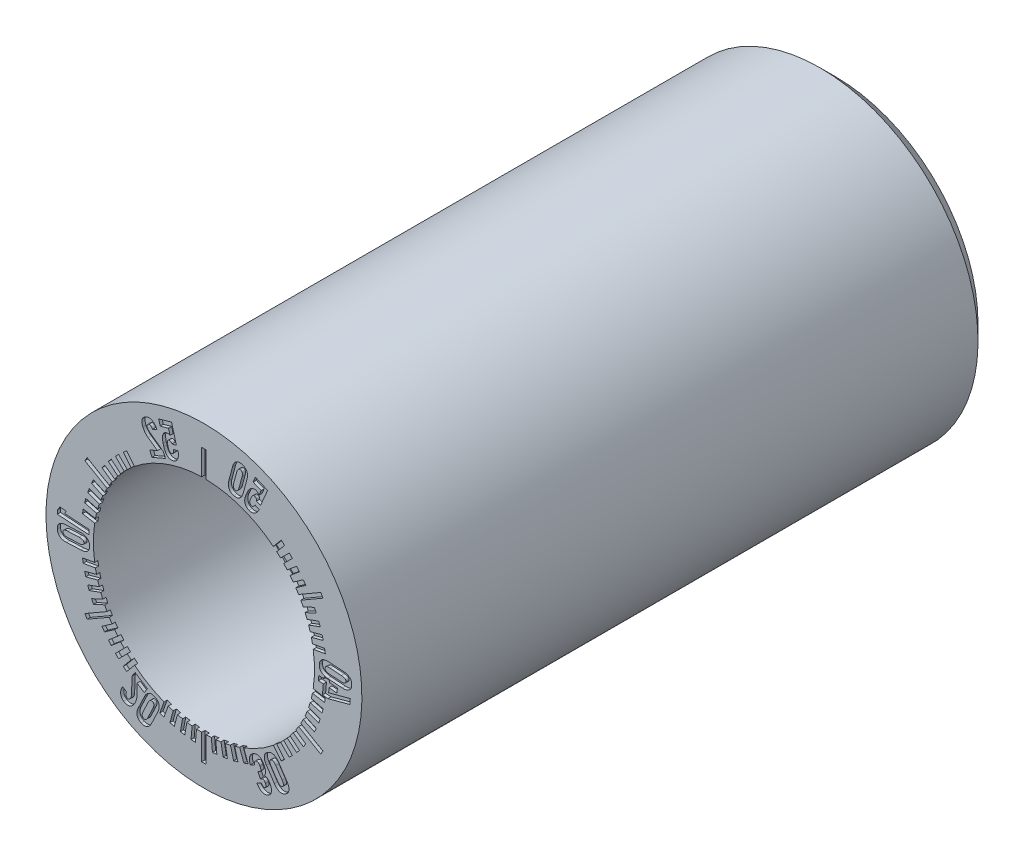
SolidWorks part; units mm, degrees
ref_plane "Front Plane" through (0, 0, 0) normal (0, 0, 1) x (1, 0, 0)
ref_plane "Top Plane" through (0, 0, 0) normal (0, 1, 0) x (1, 0, 0)
ref_plane "Right Plane" through (0, 0, 0) normal (1, 0, 0) x (0, 0, -1)
sketch "Sketch1" plane through (0, 0, 0) normal (1, 0, 0) x (0, 0, -1)
  line L0 (0, 0) -> (-75.4695, 0) construction
  line L2 (20, 2.5) -> (20, 4.5)
  line L4 (19.5, 5) -> (0, 5)
  line L5 (0, 5) -> (0, 3.5)
  line L7 (0, 3.5) -> (5, 3.5)
  line L8 (5, 3.5) -> (5, 1.25)
  line L9 (5, 1.25) -> (15, 1.25)
  line L10 (20, 2.5) -> (15, 2.5)
  line L11 (15, 1.25) -> (15, 2.5)
  line L12 (20, 4.5) -> (19.5, 5)
  point P6 (20, 5)
  dimension "D1" = 20
  dimension "D2" = 10
  dimension "D3" = 7
  dimension "D4" = 5
  dimension "D5" = 2.5
  dimension "D6" = 5
  dimension "D7" = 5
revolve "Revolve1" add sketch "Sketch1" angle 360 about L0
sketch "Sketch2" plane through (0, 0, 0) normal (0, 0, 1) x (1, 0, 0)
  line L0 (0, 0) -> (0, 5.9354) construction
  line L1 (-0.07, 3.49) -> (0.07, 3.49)
  line L2 (-0.2693, -3.8813) -> (-0.2344, -3.4828)
  line L3 (-0.07, 4.31) -> (0.07, 4.31)
  line L4 (-0.07, 4.31) -> (-0.07, 3.49)
  line L5 (3.6976, 2.2156) -> (3.7676, 2.0944)
  line L6 (0.07, 4.31) -> (0.07, 3.49)
  line L7 (3.7676, 2.0944) -> (3.0574, 1.6844)
  line L8 (3.6976, 2.2156) -> (2.9874, 1.8056)
  line L9 (2.9874, 1.8056) -> (3.0574, 1.6844)
  line L10 (3.7676, -2.0944) -> (3.6976, -2.2156)
  line L11 (-0.2344, -3.4828) -> (-0.3739, -3.4706)
  line L12 (-0.4088, -3.8691) -> (-0.3739, -3.4706)
  line L13 (-0.2693, -3.8813) -> (-0.4088, -3.8691)
  line L14 (-0.6066, -3.8431) -> (-0.5371, -3.4491)
  line L15 (-0.5371, -3.4491) -> (-0.675, -3.4248)
  line L16 (-0.7444, -3.8187) -> (-0.675, -3.4248)
  line L17 (-0.6066, -3.8431) -> (-0.7444, -3.8187)
  line L18 (-0.9392, -3.7756) -> (-0.8357, -3.3892)
  line L19 (-0.8357, -3.3892) -> (-0.9709, -3.353)
  line L20 (-1.0744, -3.7393) -> (-0.9709, -3.353)
  line L21 (-0.9392, -3.7756) -> (-1.0744, -3.7393)
  line L22 (-1.2647, -3.6793) -> (-1.1279, -3.3035)
  line L23 (-1.1279, -3.3035) -> (-1.2594, -3.2556)
  line L24 (-1.3962, -3.6315) -> (-1.2594, -3.2556)
  line L25 (-1.2647, -3.6793) -> (-1.3962, -3.6315)
  line L26 (1.7522, 3.5147) -> (1.7524, 3.5154)
  line L27 (1.7524, 3.5154) -> (1.6164, 3.5737)
  line L28 (1.6164, 3.5737) -> (1.6162, 3.573)
  line L29 (1.4666, 3.6451) -> (1.4996, 3.7221)
  line L30 (1.6626, 3.7008) -> (1.7897, 3.6463)
  line L31 (1.7897, 3.6463) -> (2.0154, 4.1729)
  line L32 (2.0154, 4.1729) -> (1.6276, 4.3391)
  line L33 (1.6276, 4.3391) -> (1.5564, 4.173)
  line L34 (1.5564, 4.173) -> (1.8081, 4.0651)
  line L35 (1.8081, 4.0651) -> (1.7387, 3.9029)
  line L36 (1.3636, 3.7804) -> (1.3306, 3.7034)
  line L37 (1.2433, 3.7095) -> (1.3609, 4.1474)
  line L38 (-2.4468, -3.0249) -> (-2.1897, -2.7185)
  line L39 (-2.1897, -2.7185) -> (-2.297, -2.6285)
  line L40 (-2.5541, -2.9349) -> (-2.297, -2.6285)
  line L41 (-2.4468, -3.0249) -> (-2.5541, -2.9349)
  line L42 (-2.7011, -2.8001) -> (-2.4183, -2.5173)
  line L43 (-2.4183, -2.5173) -> (-2.5173, -2.4183)
  line L44 (-2.8001, -2.7011) -> (-2.5173, -2.4183)
  line L45 (-2.7011, -2.8001) -> (-2.8001, -2.7011)
  line L46 (-2.9349, -2.5541) -> (-2.6285, -2.297)
  line L47 (-2.6285, -2.297) -> (-2.7185, -2.1897)
  line L48 (-3.0249, -2.4468) -> (-2.7185, -2.1897)
  line L49 (-2.9349, -2.5541) -> (-3.0249, -2.4468)
  line L50 (-3.1464, -2.2886) -> (-2.8187, -2.0591)
  line L51 (3.6976, -2.2156) -> (2.9874, -1.8056)
  line L52 (-3.2267, -2.1739) -> (-2.899, -1.9444)
  line L53 (-3.1464, -2.2886) -> (-3.2267, -2.1739)
  line L54 (3.7676, -2.0944) -> (3.0574, -1.6844)
  line L55 (3.0574, -1.6844) -> (2.9874, -1.8056)
  line L56 (0.07, -4.31) -> (-0.07, -4.31)
  line L57 (-0.07, -4.31) -> (-0.07, -3.49)
  line L58 (-3.496, -1.7074) -> (-3.1334, -1.5384)
  line L59 (-3.1334, -1.5384) -> (-3.1926, -1.4115)
  line L60 (-3.5551, -1.5805) -> (-3.1926, -1.4115)
  line L61 (-3.496, -1.7074) -> (-3.5551, -1.5805)
  line L62 (-3.6315, -1.3962) -> (-3.2556, -1.2594)
  line L63 (-3.2556, -1.2594) -> (-3.3035, -1.1279)
  line L64 (-3.6793, -1.2647) -> (-3.3035, -1.1279)
  line L65 (-3.6315, -1.3962) -> (-3.6793, -1.2647)
  line L66 (-3.7393, -1.0744) -> (-3.353, -0.9709)
  line L67 (-3.353, -0.9709) -> (-3.3892, -0.8357)
  line L68 (-3.7756, -0.9392) -> (-3.3892, -0.8357)
  line L69 (-3.7393, -1.0744) -> (-3.7756, -0.9392)
  line L70 (-3.8187, -0.7444) -> (-3.4248, -0.675)
  line L71 (-3.4248, -0.675) -> (-3.4491, -0.5371)
  line L72 (-3.8431, -0.6066) -> (-3.4491, -0.5371)
  line L73 (-3.8187, -0.7444) -> (-3.8431, -0.6066)
  line L74 (0.9064, 4.2697) -> (0.7888, 3.8318)
  line L75 (0.9445, 3.8394) -> (1.0372, 4.1845)
  line L76 (1.2054, 4.1394) -> (1.1127, 3.7943)
  line L77 (-0.8202, 3.8414) -> (-0.8203, 3.8421)
  line L78 (-0.8203, 3.8421) -> (-0.9634, 3.8027)
  line L79 (-0.9634, 3.8027) -> (-0.9632, 3.802)
  line L80 (-1.1257, 3.7654) -> (-1.1479, 3.8461)
  line L81 (-1.0067, 3.9313) -> (-0.873, 3.968)
  line L82 (-0.873, 3.968) -> (-1.0252, 4.5217)
  line L83 (-1.0252, 4.5217) -> (-1.433, 4.4096)
  line L84 (-1.433, 4.4096) -> (-1.3849, 4.2348)
  line L85 (-1.3849, 4.2348) -> (-1.1202, 4.3077)
  line L86 (-3.8431, 0.6066) -> (-3.4491, 0.5371)
  line L87 (-3.4491, 0.5371) -> (-3.4248, 0.675)
  line L88 (-3.8187, 0.7444) -> (-3.4248, 0.675)
  line L89 (-3.8431, 0.6066) -> (-3.8187, 0.7444)
  line L90 (-3.7756, 0.9392) -> (-3.3892, 0.8357)
  line L91 (-3.3892, 0.8357) -> (-3.353, 0.9709)
  line L92 (-3.7393, 1.0744) -> (-3.353, 0.9709)
  line L93 (-3.7756, 0.9392) -> (-3.7393, 1.0744)
  line L94 (-3.6793, 1.2647) -> (-3.3035, 1.1279)
  line L95 (-3.3035, 1.1279) -> (-3.2556, 1.2594)
  line L96 (-3.6315, 1.3962) -> (-3.2556, 1.2594)
  line L97 (-3.6793, 1.2647) -> (-3.6315, 1.3962)
  line L98 (-3.5551, 1.5805) -> (-3.1926, 1.4115)
  line L99 (-3.1926, 1.4115) -> (-3.1334, 1.5384)
  line L100 (-3.496, 1.7074) -> (-3.1334, 1.5384)
  line L101 (-3.5551, 1.5805) -> (-3.496, 1.7074)
  line L102 (0.07, -4.31) -> (0.07, -3.49)
  line L103 (0.07, -3.49) -> (-0.07, -3.49)
  line L104 (-3.6976, -2.2156) -> (-3.7676, -2.0944)
  line L105 (-3.7676, -2.0944) -> (-3.0574, -1.6844)
  line L106 (-3.2267, 2.1739) -> (-2.899, 1.9444)
  line L107 (-2.899, 1.9444) -> (-2.8187, 2.0591)
  line L108 (-3.1464, 2.2886) -> (-2.8187, 2.0591)
  line L109 (-3.2267, 2.1739) -> (-3.1464, 2.2886)
  line L110 (-3.0249, 2.4468) -> (-2.7185, 2.1897)
  line L111 (-2.7185, 2.1897) -> (-2.6285, 2.297)
  line L112 (-2.9349, 2.5541) -> (-2.6285, 2.297)
  line L113 (-3.0249, 2.4468) -> (-2.9349, 2.5541)
  line L114 (-2.8001, 2.7011) -> (-2.5173, 2.4183)
  line L115 (-2.5173, 2.4183) -> (-2.4183, 2.5173)
  line L116 (-2.7011, 2.8001) -> (-2.4183, 2.5173)
  line L117 (-2.8001, 2.7011) -> (-2.7011, 2.8001)
  line L118 (-2.5541, 2.9349) -> (-2.297, 2.6285)
  line L119 (-2.297, 2.6285) -> (-2.1897, 2.7185)
  line L120 (-2.4468, 3.0249) -> (-2.1897, 2.7185)
  line L121 (-2.5541, 2.9349) -> (-2.4468, 3.0249)
  line L122 (-1.1202, 4.3077) -> (-1.0734, 4.1373)
  line L123 (-1.2909, 3.8067) -> (-1.2687, 3.726)
  line L124 (-1.2841, 3.5871) -> (-1.7088, 3.8951)
  line L125 (-1.7918, 3.9918) -> (-1.7924, 3.9929)
  line L126 (-1.6267, 4.028) -> (-1.6264, 4.0274)
  line L127 (-1.6264, 4.0274) -> (-1.4866, 4.0869)
  line L128 (-1.4866, 4.0869) -> (-1.4869, 4.0875)
  line L129 (-1.9345, 3.9382) -> (-1.9342, 3.9376)
  line L130 (-1.7688, 3.73) -> (-1.4691, 3.5209)
  line L131 (-1.4691, 3.5209) -> (-1.7163, 3.4155)
  line L132 (-1.7163, 3.4155) -> (-1.6452, 3.2489)
  line L133 (-1.6452, 3.2489) -> (-1.2175, 3.4313)
  line L134 (-1.2175, 3.4313) -> (-1.2841, 3.5871)
  line L135 (-3.6395, 0.1286) -> (-3.6303, 0.277)
  line L136 (-3.6303, 0.277) -> (-4.4089, 0.3261)
  line L137 (-4.4089, 0.3261) -> (-4.3565, 0.4189)
  line L138 (-4.3565, 0.4189) -> (-4.5569, 0.4314)
  line L139 (-4.5569, 0.4314) -> (-4.6316, 0.3182)
  line L140 (-4.6316, 0.3182) -> (-4.6396, 0.1915)
  line L141 (-4.6396, 0.1915) -> (-3.6395, 0.1286)
  line L142 (-3.9129, 0.0575) -> (-4.3675, 0.0369)
  line L143 (-4.3459, -0.434) -> (-3.8912, -0.4135)
  line L144 (-3.9463, -0.2672) -> (-4.3045, -0.2835)
  line L145 (-4.3127, -0.1093) -> (-3.9544, -0.093)
  line L146 (-2.2731, -3.0574) -> (-2.2933, -3.581)
  line L147 (-2.3276, -3.7034) -> (-2.3283, -3.7044)
  line L148 (-2.4492, -3.5863) -> (-2.4488, -3.5856)
  line L149 (-2.4488, -3.5856) -> (-2.5756, -3.5026)
  line L150 (-3.6976, -2.2156) -> (-2.9874, -1.8056)
  line L151 (-2.9874, -1.8056) -> (-3.0574, -1.6844)
  line L152 (-3.7676, 2.0944) -> (-3.6976, 2.2156)
  line L153 (-3.6976, 2.2156) -> (-2.9874, 1.8056)
  line L154 (-2.5756, -3.5026) -> (-2.576, -3.5032)
  line L155 (-2.2037, -3.7927) -> (-2.2033, -3.7921)
  line L156 (-2.1229, -3.5393) -> (-2.1154, -3.1743)
  line L157 (-2.1154, -3.1743) -> (-1.8906, -3.3213)
  line L158 (-1.8906, -3.3213) -> (-1.7916, -3.1699)
  line L159 (-1.7916, -3.1699) -> (-2.1805, -2.9156)
  line L160 (-2.1805, -2.9156) -> (-2.2731, -3.0574)
  line L161 (-1.8843, -3.4306) -> (-2.0799, -3.8428)
  line L162 (-1.6537, -4.0452) -> (-1.4582, -3.6329)
  line L163 (-1.6129, -3.6129) -> (-1.7671, -3.9379)
  line L164 (-1.9251, -3.863) -> (-1.7708, -3.5381)
  line L165 (1.4706, -3.6232) -> (1.6075, -3.5568)
  line L166 (1.7679, -3.4981) -> (1.778, -3.5191)
  line L167 (1.7655, -3.6572) -> (1.7061, -3.6861)
  line L168 (1.7061, -3.6861) -> (1.7853, -3.8489)
  line L169 (1.7853, -3.8489) -> (1.8447, -3.82)
  line L170 (1.9424, -3.887) -> (1.9499, -3.9026)
  line L171 (1.8136, -3.9528) -> (1.6771, -4.019)
  line L172 (2.1004, -3.8508) -> (2.0873, -3.8236)
  line L173 (1.9139, -3.4371) -> (1.9008, -3.4101)
  line L174 (1.9767, -3.3778) -> (2.2302, -3.7568)
  line L175 (2.6239, -3.4935) -> (2.3704, -3.1145)
  line L176 (2.2733, -3.2376) -> (2.4732, -3.5365)
  line L177 (2.3274, -3.634) -> (2.1275, -3.335)
  line L178 (3.9247, -0.5816) -> (4.6177, -0.3952)
  line L179 (4.6177, -0.3952) -> (4.6317, -0.2273)
  line L180 (4.6317, -0.2273) -> (3.9476, -0.4079)
  line L181 (3.9476, -0.4079) -> (3.9595, -0.2646)
  line L182 (2.4468, 3.0249) -> (2.1897, 2.7185)
  line L183 (2.1897, 2.7185) -> (2.297, 2.6285)
  line L184 (2.5541, 2.9349) -> (2.297, 2.6285)
  line L185 (2.4468, 3.0249) -> (2.5541, 2.9349)
  line L186 (2.7011, 2.8001) -> (2.4183, 2.5173)
  line L187 (2.4183, 2.5173) -> (2.5173, 2.4183)
  line L188 (2.8001, 2.7011) -> (2.5173, 2.4183)
  line L189 (2.7011, 2.8001) -> (2.8001, 2.7011)
  line L190 (2.9349, 2.5541) -> (2.6285, 2.297)
  line L191 (2.6285, 2.297) -> (2.7185, 2.1897)
  line L192 (3.0249, 2.4468) -> (2.7185, 2.1897)
  line L193 (2.9349, 2.5541) -> (3.0249, 2.4468)
  line L194 (3.1464, 2.2886) -> (2.8187, 2.0591)
  line L195 (2.8187, 2.0591) -> (2.899, 1.9444)
  line L196 (3.2267, 2.1739) -> (2.899, 1.9444)
  line L197 (3.1464, 2.2886) -> (3.2267, 2.1739)
  line L198 (-3.7676, 2.0944) -> (-3.0574, 1.6844)
  line L199 (-3.0574, 1.6844) -> (-2.9874, 1.8056)
  line L200 (3.977, -0.0545) -> (3.7954, -0.0394)
  line L201 (3.7954, -0.0394) -> (3.7903, -0.1011)
  line L202 (3.496, 1.7074) -> (3.1334, 1.5384)
  line L203 (3.1334, 1.5384) -> (3.1926, 1.4115)
  line L204 (3.5551, 1.5805) -> (3.1926, 1.4115)
  line L205 (3.496, 1.7074) -> (3.5551, 1.5805)
  line L206 (3.6315, 1.3962) -> (3.2556, 1.2594)
  line L207 (3.2556, 1.2594) -> (3.3035, 1.1279)
  line L208 (3.6793, 1.2647) -> (3.3035, 1.1279)
  line L209 (3.6315, 1.3962) -> (3.6793, 1.2647)
  line L210 (3.7393, 1.0744) -> (3.353, 0.9709)
  line L211 (3.353, 0.9709) -> (3.3892, 0.8357)
  line L212 (3.7756, 0.9392) -> (3.3892, 0.8357)
  line L213 (3.7393, 1.0744) -> (3.7756, 0.9392)
  line L214 (3.8187, 0.7444) -> (3.4248, 0.675)
  line L215 (3.4248, 0.675) -> (3.4491, 0.5371)
  line L216 (3.8431, 0.6066) -> (3.4491, 0.5371)
  line L217 (3.8187, 0.7444) -> (3.8431, 0.6066)
  line L218 (3.7515, -0.5672) -> (3.9247, -0.5816)
  line L219 (4.2126, -0.2858) -> (4.2251, -0.1374)
  line L220 (4.2251, -0.1374) -> (3.9718, -0.1163)
  line L221 (3.6363, -0.0882) -> (3.6239, -0.2366)
  line L222 (3.6239, -0.2366) -> (3.7779, -0.2494)
  line L223 (3.9225, -0.0316) -> (4.3779, -0.0597)
  line L224 (4.4069, 0.412) -> (3.9515, 0.4401)
  line L225 (3.9907, 0.2885) -> (4.3495, 0.2663)
  line L226 (4.3388, 0.0918) -> (3.98, 0.114)
  line L227 (3.9718, -0.1163) -> (3.977, -0.0545)
  line L228 (3.9595, -0.2646) -> (4.2126, -0.2858)
  line L229 (3.7779, -0.2494) -> (3.7515, -0.5672)
  line L230 (3.8431, -0.6066) -> (3.4491, -0.5371)
  line L231 (3.4491, -0.5371) -> (3.4248, -0.675)
  line L232 (3.8187, -0.7444) -> (3.4248, -0.675)
  line L233 (3.8431, -0.6066) -> (3.8187, -0.7444)
  line L234 (3.7756, -0.9392) -> (3.3892, -0.8357)
  line L235 (3.3892, -0.8357) -> (3.353, -0.9709)
  line L236 (3.7393, -1.0744) -> (3.353, -0.9709)
  line L237 (3.7756, -0.9392) -> (3.7393, -1.0744)
  line L238 (3.6793, -1.2647) -> (3.3035, -1.1279)
  line L239 (3.3035, -1.1279) -> (3.2556, -1.2594)
  line L240 (3.6315, -1.3962) -> (3.2556, -1.2594)
  line L241 (3.6793, -1.2647) -> (3.6315, -1.3962)
  line L242 (3.5551, -1.5805) -> (3.1926, -1.4115)
  line L243 (3.1926, -1.4115) -> (3.1334, -1.5384)
  line L244 (3.496, -1.7074) -> (3.1334, -1.5384)
  line L245 (3.5551, -1.5805) -> (3.496, -1.7074)
  line L246 (3.7903, -0.1011) -> (3.6363, -0.0882)
  line L250 (3.2267, -2.1739) -> (2.899, -1.9444)
  line L251 (2.899, -1.9444) -> (2.8187, -2.0591)
  line L252 (3.1464, -2.2886) -> (2.8187, -2.0591)
  line L253 (3.2267, -2.1739) -> (3.1464, -2.2886)
  line L254 (3.0249, -2.4468) -> (2.7185, -2.1897)
  line L255 (2.7185, -2.1897) -> (2.6285, -2.297)
  line L256 (2.9349, -2.5541) -> (2.6285, -2.297)
  line L257 (3.0249, -2.4468) -> (2.9349, -2.5541)
  line L258 (2.8001, -2.7011) -> (2.5173, -2.4183)
  line L259 (2.5173, -2.4183) -> (2.4183, -2.5173)
  line L260 (2.7011, -2.8001) -> (2.4183, -2.5173)
  line L261 (2.8001, -2.7011) -> (2.7011, -2.8001)
  line L262 (2.5541, -2.9349) -> (2.297, -2.6285)
  line L263 (2.297, -2.6285) -> (2.1897, -2.7185)
  line L264 (2.4468, -3.0249) -> (2.1897, -2.7185)
  line L265 (2.5541, -2.9349) -> (2.4468, -3.0249)
  line L278 (1.3962, -3.6315) -> (1.2594, -3.2556)
  line L279 (1.2594, -3.2556) -> (1.1279, -3.3035)
  line L280 (1.2647, -3.6793) -> (1.1279, -3.3035)
  line L281 (1.3962, -3.6315) -> (1.2647, -3.6793)
  line L282 (1.0744, -3.7393) -> (0.9709, -3.353)
  line L283 (0.9709, -3.353) -> (0.8357, -3.3892)
  line L284 (0.9392, -3.7756) -> (0.8357, -3.3892)
  line L285 (1.0744, -3.7393) -> (0.9392, -3.7756)
  line L286 (0.7444, -3.8187) -> (0.675, -3.4248)
  line L287 (0.675, -3.4248) -> (0.5371, -3.4491)
  line L288 (0.6066, -3.8431) -> (0.5371, -3.4491)
  line L289 (0.7444, -3.8187) -> (0.6066, -3.8431)
  line L290 (0.4088, -3.8691) -> (0.3739, -3.4706)
  line L291 (0.3739, -3.4706) -> (0.2344, -3.4828)
  line L292 (0.2693, -3.8813) -> (0.2344, -3.4828)
  line L293 (0.4088, -3.8691) -> (0.2693, -3.8813)
  circle A0 centre (0, 0) radius 3.645 construction
  spline S0 degree 3 poles (1.4235, 3.3313) (1.4421, 3.3232) (1.4715, 3.3153) (1.5119, 3.3141) (1.5421, 3.3181) (1.572, 3.327) (1.6015, 3.3404) (1.6299, 3.3588) (1.6577, 3.3813) (1.684, 3.4087) (1.7181, 3.4519) (1.7394, 3.4887) (1.7522, 3.5147) knots 0 0 0 0 0.14551 0.216189 0.288745 0.362891 0.439837 0.519873 0.605471 0.696225 0.791727 1 1 1 1
  spline S1 degree 3 poles (1.6162, 3.573) (1.6086, 3.5584) (1.5958, 3.5384) (1.575, 3.5164) (1.5591, 3.5048) (1.5427, 3.4968) (1.5203, 3.4924) (1.5033, 3.4954) (1.4932, 3.5) knots 0 0 0 0 0.312251 0.447568 0.57105 0.683855 0.789243 1 1 1 1
  spline S2 degree 3 poles (1.4932, 3.5) (1.4821, 3.5044) (1.4672, 3.5149) (1.4547, 3.5355) (1.4497, 3.5534) (1.4482, 3.5737) (1.4517, 3.6052) (1.4598, 3.6291) (1.4666, 3.6451) knots 0 0 0 0 0.215181 0.318298 0.428714 0.549185 0.683344 1 1 1 1
  spline S3 degree 3 poles (1.4996, 3.7221) (1.5067, 3.738) (1.5178, 3.7605) (1.5375, 3.7849) (1.5521, 3.7981) (1.5676, 3.807) (1.5888, 3.8134) (1.6054, 3.8104) (1.6151, 3.8062) knots 0 0 0 0 0.329509 0.46604 0.588877 0.698332 0.799556 1 1 1 1
  spline S4 degree 3 poles (1.6151, 3.8062) (1.6245, 3.8025) (1.637, 3.7941) (1.65, 3.779) (1.6573, 3.7659) (1.6623, 3.7514) (1.6661, 3.7295) (1.6646, 3.7124) (1.6626, 3.7008) knots 0 0 0 0 0.239138 0.35446 0.473242 0.594435 0.719473 1 1 1 1
  spline S5 degree 3 poles (1.7387, 3.9029) (1.7363, 3.9117) (1.7306, 3.9244) (1.7198, 3.94) (1.7098, 3.9511) (1.6987, 3.9615) (1.6834, 3.974) (1.6703, 3.9808) (1.6616, 3.9848) knots 0 0 0 0 0.234743 0.357589 0.489557 0.621607 0.751153 1 1 1 1
  spline S6 degree 3 poles (1.6616, 3.9848) (1.6439, 3.9925) (1.6161, 3.9998) (1.5783, 3.9993) (1.5509, 3.9937) (1.524, 3.9834) (1.4979, 3.968) (1.4729, 3.9477) (1.4485, 3.9229) (1.4251, 3.8936) (1.3945, 3.8469) (1.3755, 3.8078) (1.3636, 3.7804) knots 0 0 0 0 0.142456 0.209737 0.278264 0.348619 0.422078 0.501376 0.586938 0.679293 0.778391 1 1 1 1
  spline S7 degree 3 poles (1.3306, 3.7034) (1.3187, 3.676) (1.3041, 3.6348) (1.2934, 3.5796) (1.2898, 3.5417) (1.2911, 3.5059) (1.2966, 3.4725) (1.3067, 3.4415) (1.3215, 3.4132) (1.3407, 3.3878) (1.3727, 3.3572) (1.4024, 3.3404) (1.4235, 3.3313) knots 0 0 0 0 0.207205 0.30056 0.38813 0.470353 0.54751 0.621917 0.69479 0.767182 0.84103 1 1 1 1
  spline S8 degree 3 poles (0.9424, 3.497) (0.96, 3.4923) (0.9861, 3.4871) (1.0208, 3.4863) (1.0451, 3.4881) (1.0684, 3.4929) (1.0905, 3.5005) (1.1117, 3.5106) (1.1316, 3.5235) (1.1502, 3.5391) (1.1678, 3.5567) (1.1839, 3.5767) (1.1984, 3.5991) (1.2118, 3.6234) (1.2284, 3.6598) (1.2377, 3.6892) (1.2433, 3.7095) knots 0 0 0 0 0.130125 0.190043 0.248118 0.30432 0.359877 0.415244 0.472075 0.529687 0.589088 0.650165 0.71355 0.779781 0.849253 1 1 1 1
  spline S9 degree 3 poles (1.3609, 4.1474) (1.3666, 4.1678) (1.3728, 4.1982) (1.3771, 4.2383) (1.3778, 4.2662) (1.3762, 4.2928) (1.3722, 4.3181) (1.3661, 4.3421) (1.3574, 4.3647) (1.3464, 4.3857) (1.3334, 4.4052) (1.3179, 4.4227) (1.3002, 4.4385) (1.28, 4.4521) (1.2498, 4.4688) (1.2246, 4.4774) (1.2072, 4.4822) knots 0 0 0 0 0.152021 0.22196 0.288627 0.351813 0.412711 0.471572 0.529047 0.585498 0.641233 0.69665 0.752785 0.810394 0.870774 1 1 1 1
  spline S10 degree 3 poles (1.2072, 4.4822) (1.1897, 4.4869) (1.1635, 4.492) (1.1288, 4.4929) (1.1046, 4.491) (1.0814, 4.4864) (1.0593, 4.4791) (1.0382, 4.469) (1.0184, 4.4561) (0.9996, 4.441) (0.9824, 4.4233) (0.9661, 4.4036) (0.9514, 4.3813) (0.9382, 4.3567) (0.9217, 4.3198) (0.912, 4.2902) (0.9064, 4.2697) knots 0 0 0 0 0.130052 0.189936 0.247978 0.303825 0.358986 0.414322 0.470688 0.527983 0.586757 0.647395 0.710773 0.777466 0.847432 1 1 1 1
  spline S11 degree 3 poles (0.7888, 3.8318) (0.7831, 3.8113) (0.7769, 3.7809) (0.7726, 3.7408) (0.7718, 3.7129) (0.7737, 3.6863) (0.7776, 3.661) (0.7838, 3.6369) (0.7923, 3.6142) (0.8033, 3.5932) (0.8163, 3.5737) (0.8318, 3.5562) (0.8496, 3.5407) (0.8695, 3.5267) (0.9, 3.5105) (0.925, 3.5017) (0.9424, 3.497) knots 0 0 0 0 0.152013 0.221948 0.288611 0.352065 0.412959 0.471817 0.529595 0.586042 0.641774 0.697189 0.752748 0.810877 0.870781 1 1 1 1
  spline S12 degree 3 poles (0.9895, 3.6718) (0.9763, 3.6749) (0.958, 3.6848) (0.9418, 3.7068) (0.9349, 3.7271) (0.9319, 3.7505) (0.9323, 3.7888) (0.9393, 3.8187) (0.9445, 3.8394) knots 0 0 0 0 0.207947 0.307153 0.413252 0.533042 0.670172 1 1 1 1
  spline S13 degree 3 poles (1.0372, 4.1845) (1.0426, 4.2053) (1.0525, 4.2342) (1.0709, 4.2678) (1.0853, 4.2866) (1.1015, 4.3006) (1.1264, 4.3118) (1.1474, 4.3106) (1.1603, 4.3072) knots 0 0 0 0 0.330543 0.467342 0.586507 0.693199 0.792612 1 1 1 1
  spline S14 degree 3 poles (1.1603, 4.3072) (1.1732, 4.3037) (1.1921, 4.2944) (1.2078, 4.272) (1.215, 4.2518) (1.218, 4.2283) (1.2173, 4.1901) (1.2109, 4.1602) (1.2054, 4.1394) knots 0 0 0 0 0.207475 0.307012 0.413819 0.533498 0.669079 1 1 1 1
  spline S15 degree 3 poles (1.1127, 3.7943) (1.1071, 3.7735) (1.0972, 3.7447) (1.0789, 3.7111) (1.0645, 3.6923) (1.0483, 3.6782) (1.0233, 3.6674) (1.0025, 3.668) (0.9895, 3.6718) knots 0 0 0 0 0.330589 0.466459 0.586759 0.693542 0.792196 1 1 1 1
  spline S16 degree 3 poles (-0.9634, 3.492) (-0.9437, 3.4971) (-0.9157, 3.5097) (-0.8833, 3.534) (-0.862, 3.556) (-0.844, 3.5816) (-0.8296, 3.6106) (-0.8185, 3.6427) (-0.8111, 3.6779) (-0.8074, 3.7157) (-0.8074, 3.7709) (-0.8143, 3.8129) (-0.8202, 3.8414) knots 0 0 0 0 0.145415 0.216819 0.289347 0.36334 0.440076 0.520125 0.605778 0.696496 0.791544 1 1 1 1
  spline S17 degree 3 poles (-0.9632, 3.802) (-0.9603, 3.7858) (-0.9577, 3.7621) (-0.9604, 3.7319) (-0.9653, 3.7128) (-0.9735, 3.6966) (-0.9877, 3.6787) (-1.0032, 3.6707) (-1.014, 3.6677) knots 0 0 0 0 0.31311 0.44728 0.570879 0.683538 0.788832 1 1 1 1
  spline S18 degree 3 poles (-1.014, 3.6677) (-1.0254, 3.6647) (-1.0439, 3.6631) (-1.0664, 3.6718) (-1.0817, 3.6827) (-1.0955, 3.6977) (-1.1125, 3.7246) (-1.1209, 3.7485) (-1.1257, 3.7654) knots 0 0 0 0 0.215344 0.318808 0.428769 0.550081 0.683403 1 1 1 1
  spline S19 degree 3 poles (-1.1479, 3.8461) (-1.1523, 3.863) (-1.1577, 3.8875) (-1.1574, 3.919) (-1.1542, 3.9385) (-1.1478, 3.9551) (-1.135, 3.9732) (-1.1202, 3.9812) (-1.1099, 3.9839) knots 0 0 0 0 0.330371 0.466736 0.589797 0.699046 0.799089 1 1 1 1
  spline S20 degree 3 poles (-1.1099, 3.9839) (-1.1003, 3.9865) (-1.0852, 3.9884) (-1.0655, 3.9846) (-1.0516, 3.9789) (-1.0385, 3.9706) (-1.0222, 3.9555) (-1.0122, 3.9416) (-1.0067, 3.9313) knots 0 0 0 0 0.238364 0.355276 0.47308 0.594658 0.7216 1 1 1 1
  spline S21 degree 3 poles (-1.0734, 4.1373) (-1.0809, 4.1423) (-1.0932, 4.1492) (-1.1115, 4.1541) (-1.1406, 4.1596) (-1.166, 4.1581) (-1.1852, 4.153) knots 0 0 0 0 0.235052 0.357896 0.488415 1 1 1 1
  spline S22 degree 3 poles (-1.1852, 4.153) (-1.2038, 4.1482) (-1.23, 4.1363) (-1.2594, 4.1124) (-1.2774, 4.091) (-1.2922, 4.0661) (-1.3029, 4.0377) (-1.3102, 4.0062) (-1.3136, 3.9715) (-1.3135, 3.934) (-1.3081, 3.8782) (-1.2991, 3.8356) (-1.2909, 3.8067) knots 0 0 0 0 0.141925 0.209431 0.277841 0.348142 0.422142 0.500944 0.586672 0.678948 0.777953 1 1 1 1
  spline S23 degree 3 poles (-1.2687, 3.726) (-1.2608, 3.697) (-1.2466, 3.6556) (-1.2206, 3.6056) (-1.1995, 3.5738) (-1.1762, 3.5465) (-1.1509, 3.5239) (-1.1237, 3.5057) (-1.0944, 3.4928) (-1.0635, 3.4846) (-1.0192, 3.4808) (-0.9856, 3.4858) (-0.9634, 3.492) knots 0 0 0 0 0.207498 0.300462 0.388251 0.470101 0.54779 0.621801 0.694772 0.767701 0.841218 1 1 1 1
  spline S24 degree 3 poles (-1.7088, 3.8951) (-1.7272, 3.9086) (-1.7593, 3.9375) (-1.7839, 3.9731) (-1.7918, 3.9918) knots 0 0 0 0 0.531264 1 1 1 1
  spline S25 degree 3 poles (-1.7924, 3.9929) (-1.7971, 4.004) (-1.8023, 4.0211) (-1.8019, 4.0438) (-1.7983, 4.0588) (-1.7914, 4.0723) (-1.7776, 4.0888) (-1.763, 4.0971) (-1.7527, 4.1016) knots 0 0 0 0 0.277151 0.398957 0.513565 0.626866 0.741851 1 1 1 1
  spline S26 degree 3 poles (-1.7527, 4.1016) (-1.7423, 4.1064) (-1.7249, 4.1094) (-1.7019, 4.1049) (-1.6851, 4.0973) (-1.6691, 4.0854) (-1.6477, 4.0634) (-1.6347, 4.0429) (-1.6267, 4.028) knots 0 0 0 0 0.212933 0.317957 0.430529 0.552793 0.685363 1 1 1 1
  spline S27 degree 3 poles (-1.4869, 4.0875) (-1.4995, 4.1139) (-1.5213, 4.1505) (-1.555, 4.1941) (-1.5816, 4.2212) (-1.6093, 4.2438) (-1.638, 4.2621) (-1.6677, 4.2755) (-1.6983, 4.284) (-1.7294, 4.2876) (-1.7718, 4.2861) (-1.803, 4.2772) (-1.8229, 4.2687) knots 0 0 0 0 0.205728 0.29964 0.388323 0.472437 0.551647 0.627418 0.701371 0.77458 0.847426 1 1 1 1
  spline S28 degree 3 poles (-1.8229, 4.2687) (-1.844, 4.2598) (-1.8734, 4.2435) (-1.9067, 4.2151) (-1.9269, 4.1919) (-1.9431, 4.1664) (-1.9549, 4.1387) (-1.9624, 4.1092) (-1.9652, 4.0777) (-1.9641, 4.0447) (-1.9567, 3.997) (-1.9444, 3.9617) (-1.9345, 3.9382) knots 0 0 0 0 0.17333 0.252927 0.330174 0.405739 0.480458 0.556707 0.635845 0.718784 0.806449 1 1 1 1
  spline S29 degree 3 poles (-1.9342, 3.9376) (-1.9252, 3.9169) (-1.91, 3.8864) (-1.885, 3.8484) (-1.8645, 3.8209) (-1.8424, 3.795) (-1.8117, 3.7633) (-1.7863, 3.7425) (-1.7688, 3.73) knots 0 0 0 0 0.252455 0.379386 0.507805 0.63511 0.75881 1 1 1 1
  spline S30 degree 3 poles (-3.6179, -0.1651) (-3.6184, -0.1469) (-3.6222, -0.1205) (-3.6314, -0.0869) (-3.641, -0.0645) (-3.6525, -0.0437) (-3.6663, -0.0247) (-3.6828, -0.0077) (-3.7012, 0.0075) (-3.7218, 0.0205) (-3.744, 0.0319) (-3.768, 0.041) (-3.7936, 0.0484) (-3.821, 0.0537) (-3.8609, 0.058) (-3.8918, 0.0585) (-3.9129, 0.0575) knots 0 0 0 0 0.12991 0.190188 0.247771 0.304069 0.359609 0.41557 0.47222 0.530006 0.589142 0.650375 0.713401 0.779628 0.849521 1 1 1 1
  spline S31 degree 3 poles (-4.3675, 0.0369) (-4.3888, 0.036) (-4.4198, 0.033) (-4.4594, 0.0247) (-4.4863, 0.0167) (-4.5113, 0.0071) (-4.5345, -0.0042) (-4.5555, -0.0176) (-4.5745, -0.0326) (-4.5914, -0.0493) (-4.6057, -0.068) (-4.6177, -0.088) (-4.6273, -0.1097) (-4.6343, -0.133) (-4.6408, -0.167) (-4.6415, -0.1936) (-4.6408, -0.2117) knots 0 0 0 0 0.152022 0.222405 0.288756 0.352364 0.413211 0.472694 0.530181 0.586364 0.642005 0.697249 0.753306 0.810995 0.870603 1 1 1 1
  spline S32 degree 3 poles (-4.6408, -0.2117) (-4.6402, -0.2298) (-4.6366, -0.2563) (-4.6272, -0.2897) (-4.6182, -0.3124) (-4.6066, -0.333) (-4.5931, -0.3521) (-4.5769, -0.3689) (-4.5588, -0.3841) (-4.5383, -0.3972) (-4.5162, -0.4085) (-4.4923, -0.4178) (-4.4665, -0.4251) (-4.4389, -0.4303) (-4.3985, -0.4346) (-4.3673, -0.4351) (-4.3459, -0.434) knots 0 0 0 0 0.129764 0.189975 0.247205 0.303441 0.35867 0.413585 0.469827 0.527167 0.586236 0.646966 0.710374 0.776992 0.847282 1 1 1 1
  spline S33 degree 3 poles (-3.8912, -0.4135) (-3.87, -0.4125) (-3.8389, -0.4096) (-3.7994, -0.4011) (-3.7724, -0.3936) (-3.7477, -0.3835) (-3.7245, -0.3725) (-3.7036, -0.3589) (-3.6846, -0.344) (-3.6678, -0.3272) (-3.6531, -0.3089) (-3.6413, -0.2887) (-3.6314, -0.2671) (-3.6244, -0.2437) (-3.6179, -0.2098) (-3.6172, -0.1832) (-3.6179, -0.1651) knots 0 0 0 0 0.15212 0.222066 0.288843 0.352161 0.413048 0.472138 0.529661 0.585881 0.641537 0.696816 0.753147 0.810873 0.870519 1 1 1 1
  spline S34 degree 3 poles (-3.7995, -0.1734) (-3.7991, -0.1867) (-3.8019, -0.2077) (-3.8189, -0.2292) (-3.8359, -0.2421) (-3.8574, -0.2523) (-3.8943, -0.2629) (-3.9247, -0.2663) (-3.9463, -0.2672) knots 0 0 0 0 0.207162 0.306024 0.412429 0.53284 0.668983 1 1 1 1
  spline S35 degree 3 poles (-4.3045, -0.2835) (-4.3261, -0.2844) (-4.3568, -0.2842) (-4.3944, -0.2767) (-4.4169, -0.2687) (-4.4351, -0.2574) (-4.4533, -0.2371) (-4.4588, -0.2169) (-4.4592, -0.2035) knots 0 0 0 0 0.331217 0.467354 0.587597 0.694524 0.792893 1 1 1 1
  spline S36 degree 3 poles (-4.4592, -0.2035) (-4.4599, -0.1901) (-4.4564, -0.1694) (-4.4403, -0.1473) (-4.423, -0.1345) (-4.4015, -0.1242) (-4.3646, -0.1137) (-4.3342, -0.1102) (-4.3127, -0.1093) knots 0 0 0 0 0.207046 0.306674 0.412979 0.533277 0.669293 1 1 1 1
  spline S37 degree 3 poles (-3.9544, -0.093) (-3.9329, -0.0921) (-3.9022, -0.0923) (-3.8645, -0.0998) (-3.8421, -0.1078) (-3.8238, -0.1192) (-3.8054, -0.1396) (-3.7999, -0.1599) (-3.7995, -0.1734) knots 0 0 0 0 0.330392 0.46619 0.586134 0.692794 0.792372 1 1 1 1
  spline S38 degree 3 poles (-2.2933, -3.581) (-2.2937, -3.6038) (-2.3003, -3.6465) (-2.3165, -3.6865) (-2.3276, -3.7034) knots 0 0 0 0 0.530944 1 1 1 1
  spline S39 degree 3 poles (-2.3283, -3.7044) (-2.3348, -3.7145) (-2.3462, -3.728) (-2.3648, -3.7406) (-2.3792, -3.7461) (-2.3943, -3.7479) (-2.4157, -3.7454) (-2.4309, -3.7381) (-2.4404, -3.7319) knots 0 0 0 0 0.276622 0.396327 0.511382 0.624843 0.739615 1 1 1 1
  spline S40 degree 3 poles (-2.4404, -3.7319) (-2.4498, -3.7257) (-2.4625, -3.7133) (-2.471, -3.6916) (-2.4742, -3.6735) (-2.4733, -3.6535) (-2.467, -3.6234) (-2.457, -3.6012) (-2.4492, -3.5863) knots 0 0 0 0 0.211714 0.316612 0.428463 0.551662 0.68591 1 1 1 1
  spline S41 degree 3 poles (-2.576, -3.5032) (-2.5904, -3.5285) (-2.6099, -3.5666) (-2.6267, -3.6191) (-2.6349, -3.656) (-2.6383, -3.6916) (-2.6376, -3.7255) (-2.6321, -3.7576) (-2.6223, -3.7878) (-2.6081, -3.8157) (-2.583, -3.85) (-2.5584, -3.8711) (-2.5402, -3.8828) knots 0 0 0 0 0.205826 0.299888 0.388484 0.472378 0.551507 0.627072 0.701237 0.774222 0.847372 1 1 1 1
  spline S42 degree 3 poles (-2.5402, -3.8828) (-2.5211, -3.8954) (-2.4911, -3.9109) (-2.4491, -3.9228) (-2.4186, -3.9268) (-2.3884, -3.926) (-2.3589, -3.9205) (-2.3302, -3.9103) (-2.3024, -3.8955) (-2.2755, -3.8764) (-2.2406, -3.8433) (-2.2176, -3.8141) (-2.2037, -3.7927) knots 0 0 0 0 0.173732 0.25355 0.330505 0.406082 0.481188 0.557131 0.636157 0.719312 0.806644 1 1 1 1
  spline S43 degree 3 poles (-2.2033, -3.7921) (-2.191, -3.7732) (-2.1743, -3.7434) (-2.1564, -3.7015) (-2.1449, -3.6692) (-2.1359, -3.6365) (-2.1267, -3.5934) (-2.1235, -3.5608) (-2.1229, -3.5393) knots 0 0 0 0 0.252598 0.380404 0.508211 0.635525 0.75958 1 1 1 1
  spline S44 degree 3 poles (-1.5489, -3.2742) (-1.5653, -3.2663) (-1.5903, -3.2569) (-1.6244, -3.2495) (-1.6487, -3.2473) (-1.6726, -3.2477) (-1.6958, -3.2513) (-1.7186, -3.2576) (-1.7405, -3.267) (-1.7618, -3.2788) (-1.7822, -3.2932) (-1.8016, -3.31) (-1.8202, -3.3292) (-1.8377, -3.3511) (-1.8605, -3.3843) (-1.8753, -3.4115) (-1.8843, -3.4306) knots 0 0 0 0 0.129828 0.190159 0.248082 0.304026 0.359887 0.41545 0.472043 0.529659 0.588953 0.649558 0.712987 0.779339 0.848981 1 1 1 1
  spline S45 degree 3 poles (-2.0799, -3.8428) (-2.0893, -3.862) (-2.1007, -3.8911) (-2.1124, -3.9299) (-2.118, -3.9574) (-2.1213, -3.984) (-2.122, -4.0098) (-2.1201, -4.0347) (-2.116, -4.0587) (-2.1088, -4.0814) (-2.0997, -4.103) (-2.0873, -4.1229) (-2.0729, -4.1418) (-2.0555, -4.1588) (-2.0286, -4.1808) (-2.0052, -4.1937) (-1.9889, -4.2016) knots 0 0 0 0 0.152076 0.222488 0.288617 0.352348 0.413146 0.472281 0.529971 0.586468 0.641834 0.697124 0.752856 0.810799 0.870657 1 1 1 1
  spline S46 degree 3 poles (-1.9889, -4.2016) (-1.9725, -4.2093) (-1.9476, -4.2192) (-1.9136, -4.2263) (-1.8894, -4.2288) (-1.8657, -4.2284) (-1.8427, -4.2252) (-1.82, -4.2192) (-1.7981, -4.21) (-1.7768, -4.1984) (-1.7564, -4.1841) (-1.7372, -4.167) (-1.7184, -4.1478) (-1.7007, -4.1259) (-1.6779, -4.0921) (-1.663, -4.0645) (-1.6537, -4.0452) knots 0 0 0 0 0.129444 0.189718 0.247244 0.302755 0.357734 0.412999 0.469216 0.526866 0.585621 0.646183 0.710034 0.776798 0.846976 1 1 1 1
  spline S47 degree 3 poles (-1.4582, -3.6329) (-1.449, -3.6137) (-1.4371, -3.5848) (-1.4255, -3.546) (-1.4199, -3.5184) (-1.4166, -3.4919) (-1.4159, -3.4662) (-1.4178, -3.4413) (-1.422, -3.4173) (-1.4288, -3.3944) (-1.4385, -3.373) (-1.4503, -3.3528) (-1.4652, -3.3342) (-1.4823, -3.3169) (-1.5092, -3.2951) (-1.5326, -3.2821) (-1.5489, -3.2742) knots 0 0 0 0 0.151857 0.222282 0.289103 0.352162 0.41297 0.472116 0.529816 0.586508 0.641755 0.697125 0.75334 0.810765 0.870633 1 1 1 1
  spline S48 degree 3 poles (-1.627, -3.439) (-1.6147, -3.4446) (-1.5984, -3.4576) (-1.5863, -3.4822) (-1.5833, -3.5035) (-1.5844, -3.5272) (-1.5921, -3.5649) (-1.6036, -3.5934) (-1.6129, -3.6129) knots 0 0 0 0 0.206631 0.306093 0.412851 0.532299 0.669019 1 1 1 1
  spline S49 degree 3 poles (-1.7671, -3.9379) (-1.7765, -3.9572) (-1.7911, -3.9843) (-1.8154, -4.0141) (-1.8332, -4.0301) (-1.8518, -4.0409) (-1.8783, -4.0477) (-1.8988, -4.043) (-1.9108, -4.0371) knots 0 0 0 0 0.33039 0.467025 0.587718 0.694397 0.793466 1 1 1 1
  spline S50 degree 3 poles (-1.9108, -4.0371) (-1.9229, -4.0312) (-1.9399, -4.0187) (-1.9514, -3.9937) (-1.9549, -3.9725) (-1.9536, -3.9487) (-1.9457, -3.911) (-1.9344, -3.8825) (-1.9251, -3.863) knots 0 0 0 0 0.20735 0.306899 0.412975 0.533701 0.669543 1 1 1 1
  spline S51 degree 3 poles (-1.7708, -3.5381) (-1.7618, -3.5185) (-1.7468, -3.4917) (-1.7225, -3.4619) (-1.7048, -3.4459) (-1.6863, -3.4351) (-1.6597, -3.4284) (-1.6391, -3.4331) (-1.627, -3.439) knots 0 0 0 0 0.33031 0.466874 0.586465 0.693088 0.792105 1 1 1 1
  spline S52 degree 3 poles (1.5741, -3.2627) (1.554, -3.2729) (1.5252, -3.2904) (1.494, -3.3216) (1.4742, -3.3471) (1.4586, -3.3753) (1.4468, -3.4057) (1.4399, -3.4384) (1.4368, -3.473) (1.4382, -3.5092) (1.4466, -3.5604) (1.4597, -3.5983) (1.4706, -3.6232) knots 0 0 0 0 0.161398 0.238203 0.314458 0.391188 0.467993 0.54684 0.629278 0.715406 0.805117 1 1 1 1
  spline S53 degree 3 poles (1.6075, -3.5568) (1.6042, -3.5477) (1.6003, -3.5342) (1.5977, -3.5162) (1.5971, -3.5001) (1.5994, -3.4813) (1.6102, -3.4544) (1.6266, -3.4398) (1.6393, -3.434) knots 0 0 0 0 0.207236 0.299791 0.389528 0.551864 0.701457 1 1 1 1
  spline S54 degree 3 poles (1.6393, -3.434) (1.6508, -3.4286) (1.6692, -3.4231) (1.694, -3.4258) (1.7113, -3.4322) (1.7277, -3.4429) (1.7488, -3.4636) (1.7608, -3.4837) (1.7679, -3.4981) knots 0 0 0 0 0.23514 0.343495 0.45588 0.574464 0.701919 1 1 1 1
  spline S55 degree 3 poles (1.778, -3.5191) (1.7853, -3.5344) (1.7943, -3.5568) (1.8001, -3.5867) (1.8004, -3.6058) (1.7973, -3.6228) (1.7878, -3.6423) (1.7751, -3.6527) (1.7655, -3.6572) knots 0 0 0 0 0.327508 0.464302 0.585748 0.695019 0.795753 1 1 1 1
  spline S56 degree 3 poles (1.8447, -3.82) (1.8525, -3.816) (1.8659, -3.8136) (1.8835, -3.818) (1.8965, -3.8254) (1.9088, -3.8363) (1.9261, -3.8558) (1.9359, -3.8742) (1.9424, -3.887) knots 0 0 0 0 0.196961 0.297232 0.40851 0.532228 0.670451 1 1 1 1
  spline S57 degree 3 poles (1.9499, -3.9026) (1.9557, -3.9149) (1.9631, -3.9331) (1.9667, -3.9576) (1.9665, -3.9735) (1.9627, -3.9877) (1.9537, -4.0043) (1.9424, -4.0133) (1.9339, -4.0172) knots 0 0 0 0 0.315839 0.447769 0.568773 0.679703 0.784577 1 1 1 1
  spline S58 degree 3 poles (1.9339, -4.0172) (1.928, -4.0199) (1.9185, -4.0227) (1.9053, -4.0228) (1.8952, -4.0213) (1.8848, -4.0184) (1.8745, -4.0134) (1.864, -4.0073) (1.8537, -3.9992) (1.8432, -3.99) (1.8292, -3.9748) (1.8195, -3.962) (1.8136, -3.9528) knots 0 0 0 0 0.131174 0.196582 0.264881 0.337554 0.413821 0.495578 0.583469 0.677004 0.778375 1 1 1 1
  spline S59 degree 3 poles (1.6771, -4.019) (1.6914, -4.0439) (1.7149, -4.0788) (1.7515, -4.1191) (1.7797, -4.1439) (1.8086, -4.1647) (1.8384, -4.1807) (1.8687, -4.1921) (1.8993, -4.199) (1.93, -4.2009) (1.9707, -4.1976) (2, -4.1878) (2.0183, -4.1789) knots 0 0 0 0 0.206233 0.300725 0.39071 0.475793 0.55616 0.633068 0.70798 0.780991 0.8532 1 1 1 1
  spline S60 degree 3 poles (2.0183, -4.1789) (2.0329, -4.1716) (2.054, -4.1597) (2.0782, -4.1397) (2.0939, -4.124) (2.1074, -4.107) (2.1185, -4.0886) (2.1271, -4.0689) (2.1337, -4.0481) (2.138, -4.0263) (2.1396, -4.0035) (2.139, -3.9799) (2.1358, -3.9556) (2.1309, -3.9304) (2.1197, -3.8949) (2.1091, -3.8683) (2.1004, -3.8508) knots 0 0 0 0 0.127879 0.187598 0.244709 0.300934 0.356527 0.411847 0.46859 0.526474 0.58532 0.646714 0.710101 0.776725 0.847208 1 1 1 1
  spline S61 degree 3 poles (2.0873, -3.8236) (2.078, -3.8039) (2.0608, -3.7769) (2.0331, -3.7456) (2.0104, -3.7267) (1.9863, -3.7114) (1.9522, -3.6966) (1.9246, -3.6922) (1.9063, -3.6918) knots 0 0 0 0 0.276269 0.405 0.529367 0.650067 0.767129 1 1 1 1
  spline S62 degree 3 poles (1.9063, -3.6918) (1.9207, -3.6791) (1.9376, -3.6548) (1.9495, -3.6169) (1.9529, -3.585) (1.951, -3.5507) (1.9412, -3.4998) (1.926, -3.4623) (1.9139, -3.4371) knots 0 0 0 0 0.209454 0.317011 0.433463 0.559175 0.693372 1 1 1 1
  spline S63 degree 3 poles (1.9008, -3.4101) (1.8888, -3.3859) (1.8694, -3.3515) (1.8372, -3.312) (1.8126, -3.2876) (1.7864, -3.2677) (1.7587, -3.2527) (1.7299, -3.2422) (1.6999, -3.2367) (1.6691, -3.236) (1.626, -3.2415) (1.5945, -3.2529) (1.5741, -3.2627) knots 0 0 0 0 0.199499 0.289866 0.374565 0.455297 0.531612 0.606117 0.680338 0.755532 0.832808 1 1 1 1
  spline S64 degree 3 poles (2.0154, -3.0094) (2.0003, -3.0197) (1.9789, -3.036) (1.9553, -3.0618) (1.9407, -3.0815) (1.9287, -3.1021) (1.9198, -3.1239) (1.9135, -3.1467) (1.9103, -3.1704) (1.9094, -3.1947) (1.9114, -3.2196) (1.9159, -3.245) (1.9227, -3.2708) (1.9325, -3.297) (1.9492, -3.3336) (1.9651, -3.3602) (1.9767, -3.3778) knots 0 0 0 0 0.130196 0.190569 0.24848 0.304649 0.360347 0.415975 0.472478 0.530411 0.589543 0.650277 0.713532 0.780028 0.849591 1 1 1 1
  spline S65 degree 3 poles (2.2302, -3.7568) (2.2421, -3.7745) (2.2607, -3.7997) (2.2885, -3.8292) (2.309, -3.8484) (2.3303, -3.8648) (2.3521, -3.8784) (2.3744, -3.8898) (2.3973, -3.898) (2.4203, -3.904) (2.4437, -3.9066) (2.4672, -3.9067) (2.4908, -3.9033) (2.5145, -3.8974) (2.5471, -3.8852) (2.5705, -3.8722) (2.5856, -3.8619) knots 0 0 0 0 0.152058 0.222196 0.288776 0.351905 0.41274 0.471914 0.529528 0.585761 0.641042 0.696559 0.752478 0.810236 0.870141 1 1 1 1
  spline S66 degree 3 poles (2.5856, -3.8619) (2.6007, -3.8517) (2.622, -3.8353) (2.6456, -3.8098) (2.6601, -3.7902) (2.6723, -3.7697) (2.6815, -3.7481) (2.6875, -3.7254) (2.6913, -3.702) (2.6922, -3.6777) (2.6902, -3.6529) (2.6857, -3.6275) (2.6787, -3.6017) (2.6689, -3.5752) (2.6517, -3.5384) (2.6359, -3.5112) (2.6239, -3.4935) knots 0 0 0 0 0.129992 0.189816 0.247167 0.303313 0.358926 0.413986 0.470168 0.527388 0.586427 0.647066 0.710515 0.776907 0.847398 1 1 1 1
  spline S67 degree 3 poles (2.3704, -3.1145) (2.3585, -3.0967) (2.3398, -3.0717) (2.3123, -3.042) (2.2916, -3.023) (2.2703, -3.0068) (2.2486, -2.9927) (2.2262, -2.9819) (2.2035, -2.9732) (2.1803, -2.9677) (2.1569, -2.9648) (2.1334, -2.9649) (2.1099, -2.9681) (2.0862, -2.9739) (2.0538, -2.9864) (2.0304, -2.9992) (2.0154, -3.0094) knots 0 0 0 0 0.152227 0.222002 0.288489 0.352156 0.413142 0.471865 0.529524 0.585892 0.641702 0.696833 0.753234 0.810379 0.870681 1 1 1 1
  spline S68 degree 3 poles (2.1165, -3.1607) (2.1276, -3.1532) (2.1472, -3.1453) (2.1745, -3.148) (2.1945, -3.156) (2.2144, -3.1692) (2.2426, -3.1953) (2.2613, -3.2197) (2.2733, -3.2376) knots 0 0 0 0 0.207103 0.306052 0.413142 0.533612 0.669375 1 1 1 1
  spline S69 degree 3 poles (2.4732, -3.5365) (2.4853, -3.5544) (2.5008, -3.5809) (2.5139, -3.617) (2.5186, -3.6404) (2.5182, -3.6619) (2.5105, -3.6882) (2.4954, -3.7031) (2.4845, -3.7107) knots 0 0 0 0 0.331175 0.466657 0.58692 0.693525 0.792745 1 1 1 1
  spline S70 degree 3 poles (2.4845, -3.7107) (2.4733, -3.7182) (2.4537, -3.7263) (2.4263, -3.7235) (2.4062, -3.7155) (2.3863, -3.7023) (2.3581, -3.6762) (2.3395, -3.6519) (2.3274, -3.634) knots 0 0 0 0 0.208263 0.307067 0.414001 0.534295 0.669859 1 1 1 1
  spline S71 degree 3 poles (2.1275, -3.335) (2.1157, -3.3171) (2.0996, -3.2908) (2.0869, -3.2545) (2.0821, -3.2311) (2.0825, -3.2096) (2.0903, -3.1832) (2.1053, -3.1682) (2.1165, -3.1607) knots 0 0 0 0 0.329968 0.46601 0.586084 0.692521 0.791585 1 1 1 1
  spline S72 degree 3 poles (3.6524, 0.2218) (3.651, 0.2036) (3.6519, 0.1768) (3.6578, 0.1425) (3.6647, 0.119) (3.6738, 0.0969) (3.6859, 0.0768) (3.7002, 0.058) (3.7169, 0.0409) (3.736, 0.0256) (3.757, 0.012) (3.7799, 0.0003) (3.8047, -0.0098) (3.8314, -0.0179) (3.8705, -0.0271) (3.9014, -0.0303) (3.9225, -0.0316) knots 0 0 0 0 0.12999 0.190197 0.248293 0.304376 0.359835 0.415334 0.472018 0.530011 0.589191 0.650167 0.713499 0.779688 0.849209 1 1 1 1
  spline S73 degree 3 poles (4.3779, -0.0597) (4.3992, -0.0611) (4.4304, -0.0612) (4.4708, -0.0573) (4.4985, -0.0523) (4.5244, -0.0454) (4.5485, -0.0365) (4.571, -0.0257) (4.5915, -0.0125) (4.6101, 0.0023) (4.6264, 0.0192) (4.6406, 0.0379) (4.6525, 0.0586) (4.6622, 0.081) (4.6719, 0.1143) (4.676, 0.1406) (4.6769, 0.1588) knots 0 0 0 0 0.15224 0.222117 0.289032 0.352359 0.413032 0.472261 0.52993 0.58612 0.641621 0.696884 0.753172 0.810845 0.870559 1 1 1 1
  spline S74 degree 3 poles (4.6769, 0.1588) (4.6782, 0.177) (4.6775, 0.2037) (4.6721, 0.238) (4.6649, 0.2615) (4.656, 0.2834) (4.6443, 0.3038) (4.63, 0.3223) (4.6135, 0.3395) (4.5946, 0.3547) (4.5738, 0.3684) (4.5509, 0.3801) (4.526, 0.3901) (4.4991, 0.3984) (4.4594, 0.4072) (4.4282, 0.4107) (4.4069, 0.412) knots 0 0 0 0 0.129726 0.18971 0.247297 0.303725 0.358513 0.413946 0.470177 0.527684 0.586352 0.647254 0.71051 0.777096 0.847459 1 1 1 1
  spline S75 degree 3 poles (3.9515, 0.4401) (3.9302, 0.4415) (3.8989, 0.4416) (3.8586, 0.4378) (3.831, 0.4325) (3.8049, 0.4261) (3.7809, 0.4168) (3.7584, 0.406) (3.7378, 0.3931) (3.7193, 0.3782) (3.7029, 0.3614) (3.6887, 0.3426) (3.6769, 0.322) (3.6671, 0.2996) (3.6574, 0.2663) (3.6533, 0.24) (3.6524, 0.2218) knots 0 0 0 0 0.152284 0.222181 0.288656 0.352256 0.41318 0.472426 0.529795 0.586001 0.641519 0.696797 0.753101 0.810791 0.870522 1 1 1 1
  spline S76 degree 3 poles (3.8343, 0.2107) (3.8352, 0.224) (3.8407, 0.2444) (3.8595, 0.2644) (3.8779, 0.2755) (3.9005, 0.2831) (3.9383, 0.2902) (3.9691, 0.2895) (3.9907, 0.2885) knots 0 0 0 0 0.207079 0.306512 0.412683 0.532608 0.668983 1 1 1 1
  spline S77 degree 3 poles (4.3495, 0.2663) (4.3711, 0.265) (4.4017, 0.2615) (4.4384, 0.2499) (4.4599, 0.2395) (4.4769, 0.2264) (4.4929, 0.2041) (4.4962, 0.1833) (4.495, 0.1699) knots 0 0 0 0 0.33067 0.467619 0.586851 0.693917 0.793094 1 1 1 1
  spline S78 degree 3 poles (4.495, 0.1699) (4.4943, 0.1565) (4.489, 0.1359) (4.47, 0.1161) (4.4517, 0.105) (4.429, 0.0975) (4.3913, 0.09) (4.3604, 0.091) (4.3388, 0.0918) knots 0 0 0 0 0.207944 0.306478 0.412602 0.532473 0.669131 1 1 1 1
  spline S79 degree 3 poles (3.98, 0.114) (3.9585, 0.1153) (3.9279, 0.1189) (3.8911, 0.1304) (3.8696, 0.141) (3.8527, 0.1542) (3.8364, 0.1763) (3.8336, 0.1973) (3.8343, 0.2107) knots 0 0 0 0 0.330405 0.467244 0.587693 0.693778 0.792128 1 1 1 1
  point P207 (0, 0)
  point P301 (0, 0)
  point P313 (0, 0)
  dimension "D1" = 0.07
  dimension "D2" = 0.14
extrude "Cut-Extrude1" cut sketch "Sketch2" against normal blind 0.1 contours L123 S23 S16 L77 L78 L79 S17 S18 L80 S19 S20 L81 L82 L83 L84 L85 L122 S21 S22 | L129 S29 L130 L131 L132 L133 L134 L124 S24 L125 S25 S26 L126 L127 L128 S27 S28 | L74 S11 S8 L37 S9 S10 L76 S15 S12 L75 S13 S14 | L36 S7 S0 L26 L27 L28 S1 S2 L29 S3 S4 L30 L31 L32 L33 L34 L35 S5 S6 | L121 L118 L120 M2 | L117 L114 L116 M2 | L113 L110 L112 M2 | L109 L106 L108 M2 | L152 L198 L153 M2 | L97 L94 L96 M2 | L93 L90 L92 M2 | L140 L141 L135 L136 L137 L138 L139 | L143 S33 S30 L142 S31 S32 L145 S37 S34 L144 S35 S36 | L73 L70 L72 M2 | L69 L66 L68 M2 | L65 L62 L64 M2 | L61 L58 L60 M2 | L104 L150 L105 M2 | L53 L50 L52 M2 | L49 L46 L48 M2 | L45 L42 L44 M2 | L41 L38 L40 M2 | L155 S43 L156 L157 L158 L159 L160 L146 S38 L147 S39 S40 L148 L149 L154 S41 S42 | L162 S47 S44 L161 S45 S46 L164 S51 S48 L163 S49 S50 | L25 L22 L24 M2 | L21 L18 L20 M2 | L17 L14 L16 M2 | L13 L2 L12 M2 | L56 L102 L57 M2 | L293 L290 L292 M2 | L289 L286 L288 M2 | L285 L282 L284 M2 | L281 L278 L280 M2 | L175 S67 S64 L174 S65 S66 L177 S71 S68 L176 S69 S70 | L173 S63 S52 L165 S53 S54 L166 S55 L167 L168 L169 S56 L170 S57 S58 L171 S59 S60 L172 S61 S62 | L265 L262 L264 M2 | L261 L258 L260 M2 | L257 L254 L256 M2 | L253 L250 L252 M2 | L10 L54 L51 M2 | L245 L242 L244 M2 | L241 L238 L240 M2 | L237 L234 L236 M2 | L233 L230 L232 M2 | L201 L246 L221 L222 L229 L218 L178 L179 L180 L181 L228 L219 L220 L227 L200 | L224 S75 S72 L223 S73 S74 L226 S79 S76 L225 S77 S78 | L185 L182 L184 M2 | L189 L186 L188 M2 | L193 L190 L192 M2 | L197 L194 L196 M2 | L5 L8 L7 M2 | L205 L202 L204 M2 | L213 L210 L212 M2 | L217 L214 L216 M2 | L6 L3 L4 M2 | L98 L99 L100 L101 | L86 L87 L88 L89 | L209 L208 L207 L206
